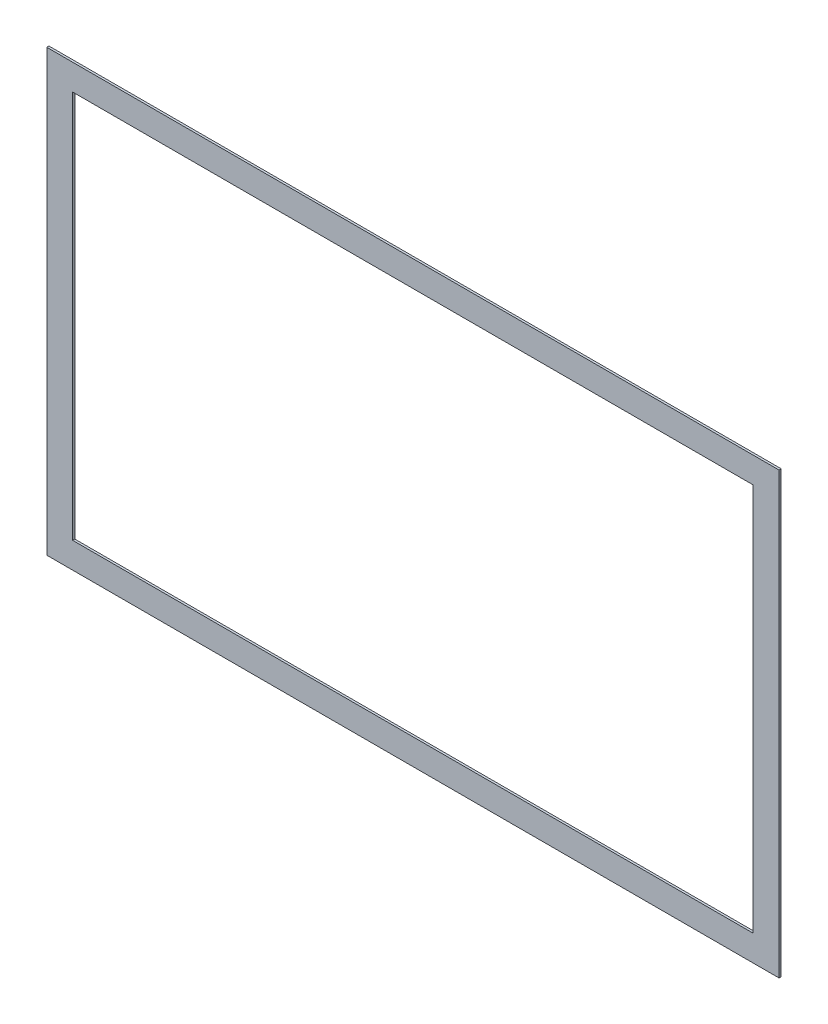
SolidWorks part; units mm, degrees
ref_plane "Alzado" through (0, 0, 0) normal (0, 0, 1) x (1, 0, 0)
ref_plane "Planta" through (0, 0, 0) normal (0, 1, 0) x (1, 0, 0)
ref_plane "Vista lateral" through (0, 0, 0) normal (1, 0, 0) x (0, 0, -1)
sketch "Croquis1" plane through (0, 0, 0) normal (0, 0, 1) x (1, 0, 0)
  line L1 (0, 0) -> (1077, 0)
  line L2 (0, 0) -> (0, 647)
  line L3 (0, 647) -> (1077, 647)
  line L4 (1077, 0) -> (1077, 647)
  line L5 (38, 38) -> (1039, 38)
  line L6 (38, 38) -> (38, 609)
  line L7 (38, 609) -> (1039, 609)
  line L8 (1039, 38) -> (1039, 609)
  dimension "D1" = 647
  dimension "D2" = 1077
  dimension "D3" = 38
  dimension "D4" = 38
  dimension "D5" = 38
  dimension "D6" = 38
extrude "Saliente-Extruir1" add sketch "Croquis1" along normal blind 3.2
